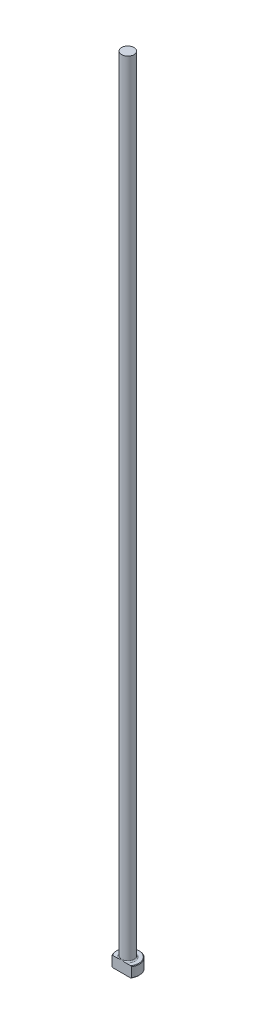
SolidWorks part; units mm, degrees
ref_plane "Front Plane" through (0, 0, 0) normal (0, 0, 1) x (1, 0, 0)
ref_plane "Top Plane" through (0, 0, 0) normal (0, 1, 0) x (1, 0, 0)
ref_plane "Right Plane" through (0, 0, 0) normal (1, 0, 0) x (0, 0, -1)
sketch "Sketch1" plane through (0, 0, 0) normal (0, 0, 1) x (1, 0, 0)
  line L0 (0, 259.9588) -> (0, -15.1925) construction
  line L1 (0, 0) -> (-5.1562, 0)
  line L2 (-5.1562, 0) -> (-5.1562, 4.7498)
  line L3 (-5.1562, 4.7498) -> (-2.7775, 4.7498)
  line L4 (-2.7775, 4.7498) -> (-2.7775, 355.6)
  line L5 (-2.7775, 355.6) -> (0, 355.6)
  line L6 (0, 355.6) -> (0, 0)
  dimension "L" = 355.6
  dimension "H" = 10.3124
  dimension "T" = 4.7498
  dimension "D" = 5.555
revolve "Revolve1" add sketch "Sketch1" angle 360 about L0
chamfer "Chamfer1" distance 0.254 angle 45 2 edges at (0, 4.7498, 5.1562) (0, 0, 5.1562)
fillet "Fillet1" radius 0.508 1 edges at (0, 4.7498, 2.7775)
sketch "Sketch2" plane through (0, 0, 0) normal (0, 1, 0) x (1, 0, 0)
  line L0 (-4.3442, -2.7775) -> (4.3442, -2.7775)
  circle A0 centre (0, 0) radius 5.1562 construction
  arc A1 (-4.3442, -2.7775) -> (4.3442, -2.7775) centre (0, 0) ccw
  circle A3 centre (0, 0) radius 2.7775 construction
  dimension "D1" = 0
extrude "Key" cut sketch "Sketch2" along normal through all
sketch "Pocket Sketch" plane through (0, 0, 0) normal (0, 0, 1) x (1, 0, 0)
  line L0 (-5.5531, 0) -> (-5.5531, 4.7752)
  line L1 (-5.5531, 4.7752) -> (-3.7379, 4.7752)
  line L2 (-2.9759, 5.5372) -> (-2.9759, 22.225)
  line L3 (-2.9759, 22.225) -> (0, 22.225)
  line L4 (0, 22.225) -> (0, 0)
  line L5 (0, 0) -> (-5.5531, 0)
  line L6 (0, 12.6104) -> (0, -2.4989) construction
  line L7 (-5.1562, 4.4958) -> (-5.1562, 0.254) construction
  line L8 (4.9022, 4.7498) -> (-4.9022, 4.7498) construction
  line L9 (-2.7775, 355.6) -> (-2.7775, 5.2578) construction
  line L10 (-3.7379, 4.7752) -> (-2.9759, 5.5372)
  point P3 (-2.9759, 4.7752)
  dimension "D1" = 11.1061
  dimension "D2" = 0.3969
  dimension "D3" = 0.0254
  dimension "D4" = 0.1984
  dimension "D5" = 5.9519
  dimension "D6" = 22.225
